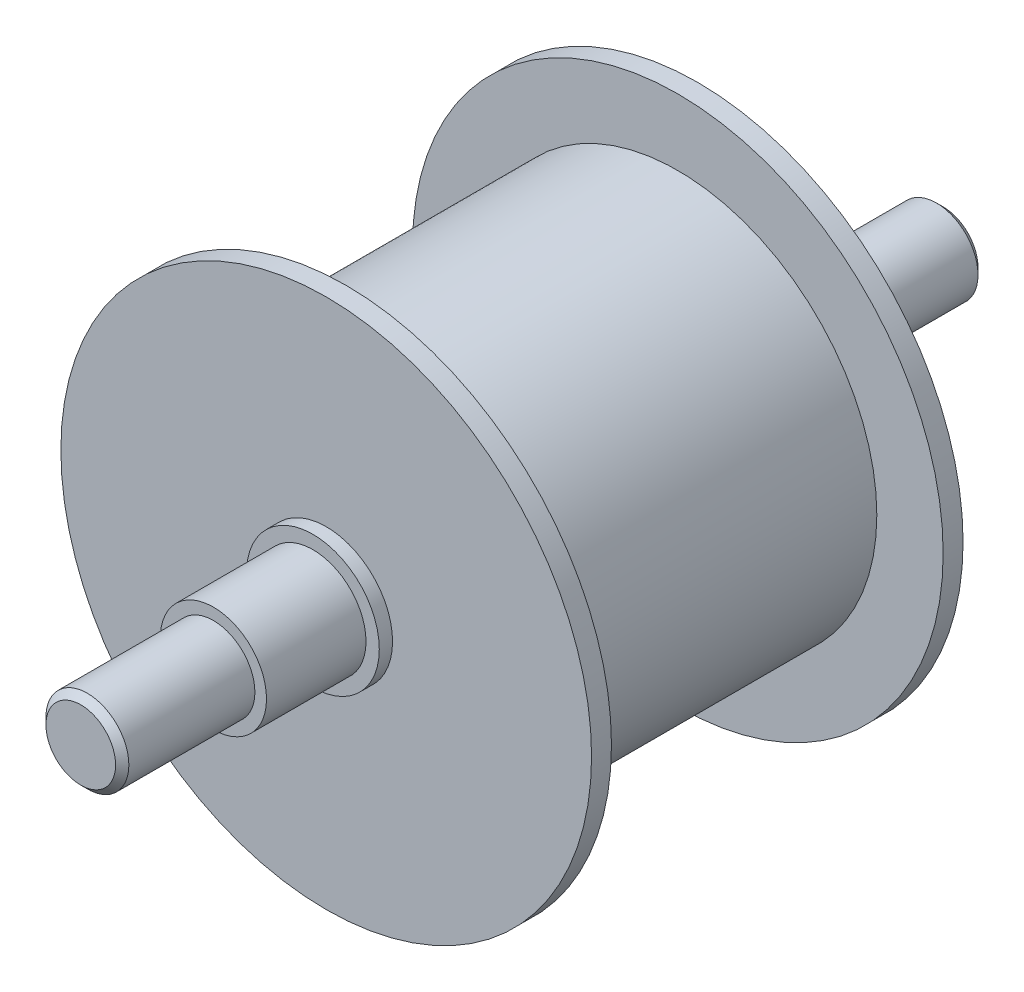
SolidWorks part; units mm, degrees
ref_plane "Ebene vorne" through (0, 0, 0) normal (0, 0, 1) x (1, 0, 0)
ref_plane "Ebene oben" through (0, 0, 0) normal (0, 1, 0) x (1, 0, 0)
ref_plane "Ebene rechts" through (0, 0, 0) normal (1, 0, 0) x (0, 0, -1)
sketch "Skizze1" plane through (0, 0, 0) normal (0, 0, 1) x (1, 0, 0)
  circle A0 centre (0, 0) radius 45
  dimension "D1" = 90
extrude "Aufsatz-Linear austragen1" add sketch "Skizze1" along normal blind 130
sketch "Skizze2" plane through (0, 0, 130) normal (0, 0, 1) x (1, 0, 0)
  circle A0 centre (0, 0) radius 6.25
  dimension "D1" = 12.5
extrude "Schnitt-Linear austragen3" cut sketch "Skizze2" against normal blind 20 flip side to cut
sketch "Skizze4" plane through (0, 0, 110) normal (0, 0, 1) x (1, 0, 0)
  circle A0 centre (0, 0) radius 8
  dimension "D1" = 16
extrude "Schnitt-Linear austragen4" cut sketch "Skizze4" against normal blind 15 flip side to cut
sketch "Skizze5" plane through (0, 0, 95) normal (0, 0, 1) x (1, 0, 0)
  circle A0 centre (0, 0) radius 10
  dimension "D1" = 20
extrude "Schnitt-Linear austragen5" cut sketch "Skizze5" against normal blind 2 flip side to cut
sketch "Skizze6" plane through (0, 0, 93) normal (0, 0, 1) x (1, 0, 0)
  circle A0 centre (0, 0) radius 40
  dimension "D1" = 80
extrude "Schnitt-Linear austragen6" cut sketch "Skizze6" against normal blind 3 flip side to cut
sketch "Skizze7" plane through (0, 0, 90) normal (0, 0, 1) x (1, 0, 0)
  circle A0 centre (0, 0) radius 30
  dimension "D1" = 60
extrude "Schnitt-Linear austragen7" cut sketch "Skizze7" against normal blind 50 flip side to cut
sketch "Skizze8" plane through (0, 0, 40) normal (0, 0, 1) x (1, 0, 0)
  circle A0 centre (0, 0) radius 40
  dimension "D1" = 80
extrude "Schnitt-Linear austragen8" cut sketch "Skizze8" against normal blind 3 flip side to cut
sketch "Skizze9" plane through (0, 0, 37) normal (0, 0, 1) x (1, 0, 0)
  circle A0 centre (0, 0) radius 10
  dimension "D1" = 20
extrude "Schnitt-Linear austragen9" cut sketch "Skizze9" against normal blind 2 flip side to cut
sketch "Skizze10" plane through (0, 0, 35) normal (0, 0, 1) x (1, 0, 0)
  circle A0 centre (0, 0) radius 8
  dimension "D1" = 16
extrude "Schnitt-Linear austragen10" cut sketch "Skizze10" against normal blind 15 flip side to cut
sketch "Skizze11" plane through (0, 0, 20) normal (0, 0, 1) x (1, 0, 0)
  circle A0 centre (0, 0) radius 6.25
  dimension "D1" = 12.5
extrude "Schnitt-Linear austragen11" cut sketch "Skizze11" against normal blind 20 flip side to cut
chamfer "Fase1" distance 1 angle 45 1 edges at (6.25, 0, 130)
chamfer "Fase2" distance 1 angle 45 1 edges at (6.25, 0, 0)
